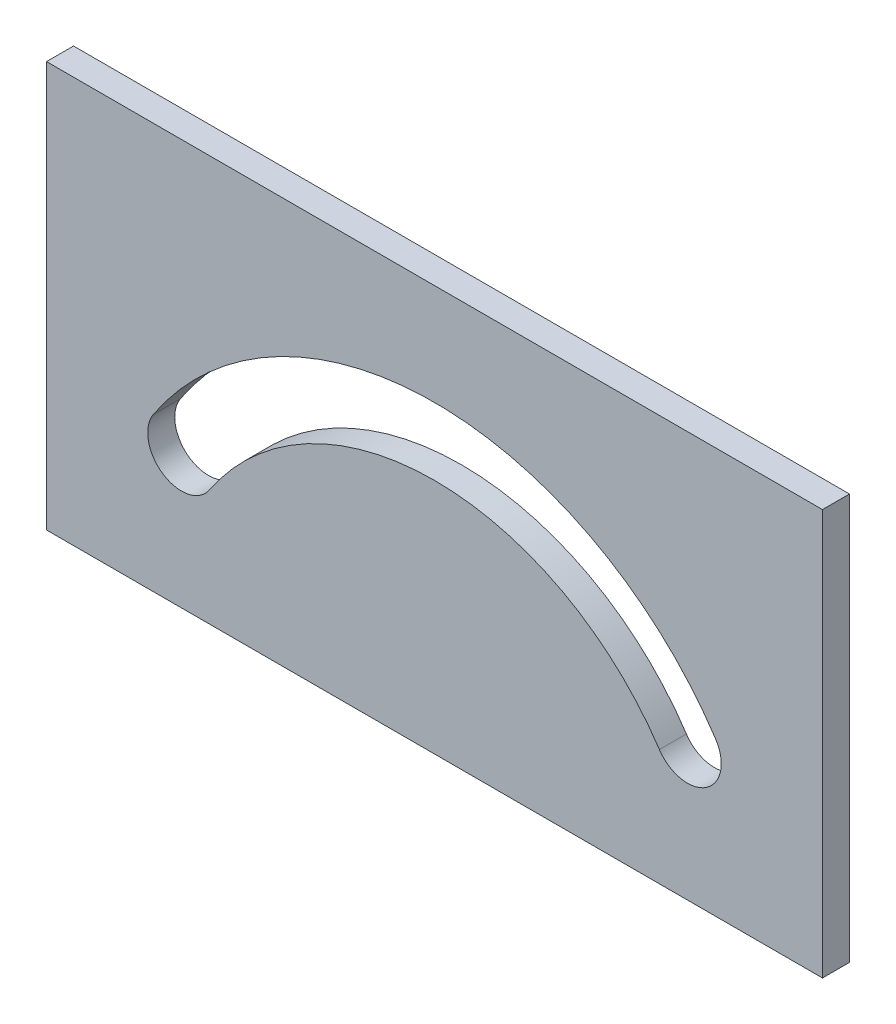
SolidWorks part; units mm, degrees
ref_plane "Front" through (0, 0, 0) normal (0, 0, 1) x (1, 0, 0)
ref_plane "Top" through (0, 0, 0) normal (0, 1, 0) x (1, 0, 0)
ref_plane "Right" through (0, 0, 0) normal (1, 0, 0) x (0, 0, -1)
sketch "Sketch1" plane through (0, 0, 0) normal (0, 0, 1) x (1, 0, 0)
  line L0 (0, 0) -> (75, 0) construction
  line L2 (-20, 40.1253) -> (95, 40.1253)
  line L3 (-20, 40.1253) -> (-20, -20)
  line L4 (-20, -20) -> (95, -20)
  line L5 (95, 40.1253) -> (95, -20)
  arc A0 (0, 0) -> (75, 0) centre (37.5, -24.8747) cw construction
  arc A1 (4.1667, -2.7639) -> (70.8333, -2.7639) centre (37.5, -24.8747) cw
  arc A2 (-4.1667, 2.7639) -> (79.1667, 2.7639) centre (37.5, -24.8747) cw
  arc A3 (4.1667, -2.7639) -> (-4.1667, 2.7639) centre (0, 0) cw
  arc A4 (70.8333, -2.7639) -> (79.1667, 2.7639) centre (75, 0) ccw
  dimension "D3" = 45
  dimension "D5" = 20
  dimension "D4" = 75
  dimension "D6" = 20
  dimension "D7" = 20
  dimension "D8" = 20
  dimension "D1" = 5
  dimension "D2" = 5
extrude "Extrude1" add sketch "Sketch1" along normal blind 4
sketch "Sketch2" plane through (0, 0, 4) normal (0, 0, 1) x (1, 0, 0)
  line L0 (37.5, 40.1253) -> (95, -7.6378)
  line L1 (95, 40.1253) -> (-20, 40.1253) construction
  line L2 (95, -20) -> (95, 40.1253) construction
  line L3 (37.5, 40.1253) -> (-20, -7.6378)
  line L4 (-20, 40.1253) -> (-20, -20) construction
  line L5 (-20, -7.6378) -> (95, -7.6378) construction
  line L6 (37.5, -7.6378) -> (69.4486, 13.5869) construction
  arc A0 (79.1667, 2.7639) -> (-4.1667, 2.7639) centre (37.5, -24.8747) ccw construction
